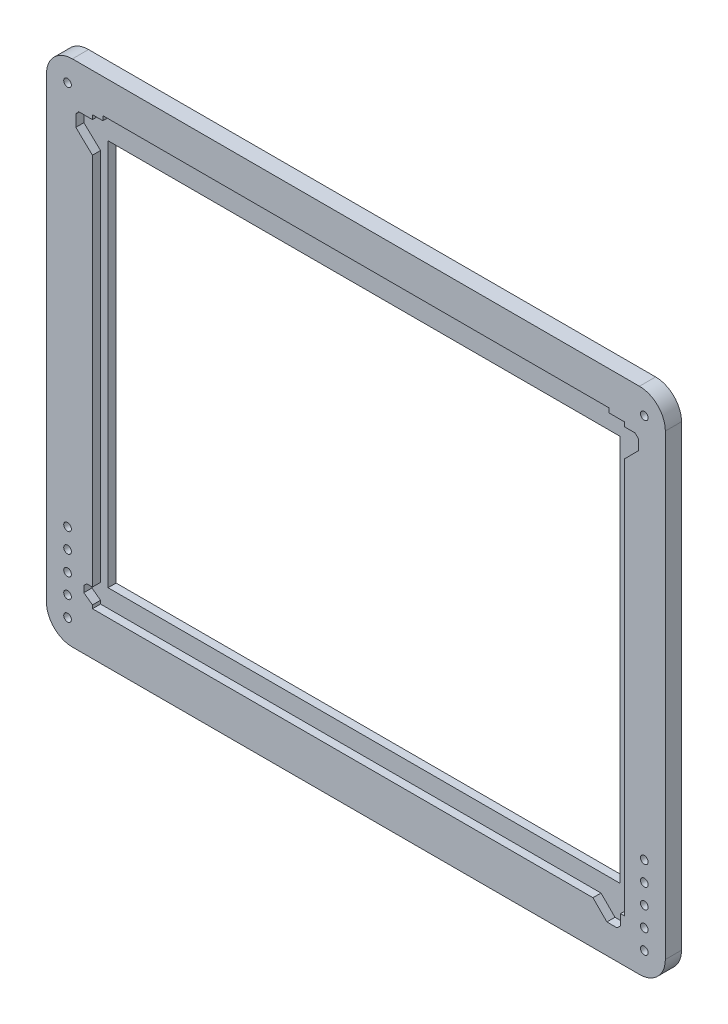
SolidWorks part; units mm, degrees
ref_plane "Front Plane" through (0, 0, 0) normal (0, 0, 1) x (1, 0, 0)
ref_plane "Top Plane" through (0, 0, 0) normal (0, 1, 0) x (1, 0, 0)
ref_plane "Right Plane" through (0, 0, 0) normal (1, 0, 0) x (0, 0, -1)
sketch "Model" plane through (0, 0, 0) normal (0, 0, 1) x (1, 0, 0)
  line L5 (502.8049, 173.3245) -> (506.8028, 173.3245)
  line L6 (285.9719, 190.015) -> (508.635, 190.015)
  line L7 (275.8119, 179.855) -> (275.8119, 0.1472)
  line L8 (285.9719, -10.0128) -> (508.635, -10.0128)
  line L9 (518.795, 179.855) -> (518.795, 0.1472)
  line L10 (275.8119, 190.015) -> (518.795, -10.0128) construction
  line L11 (275.8119, -10.0128) -> (518.795, 190.015) construction
  line L12 (506.8028, 173.3245) -> (508.2449, 172.0012)
  line L13 (508.2449, 172.0012) -> (508.2449, 168.0007)
  line L14 (508.2449, 168.0007) -> (502.8049, 162.5053)
  line L15 (293.8035, 173.3245) -> (288.3999, 173.3245)
  line L16 (502.8049, 173.3245) -> (502.8049, 175.0009)
  line L17 (288.3999, 173.3245) -> (287.2685, 172.0012)
  line L18 (287.2685, 172.0012) -> (287.2685, 168.0007)
  line L19 (287.2685, 168.0007) -> (287.2685, 167.4389)
  line L20 (287.2685, 167.4389) -> (293.8035, 161.2427)
  line L21 (490.3299, 7.0002) -> (495.8046, 1.4905)
  line L22 (495.8046, 1.4905) -> (499.8051, 1.4905)
  line L23 (499.8051, 1.4905) -> (501.1696, 2.8462)
  line L24 (501.1696, 2.8462) -> (501.1696, 7.0002)
  line L25 (293.8035, 14.3759) -> (291.5371, 14.3759)
  line L26 (291.5371, 14.3759) -> (290.417, 13.2246)
  line L27 (290.417, 13.2246) -> (290.417, 10.7666)
  line L28 (290.417, 10.7666) -> (293.8035, 8.3085)
  line L29 (293.8035, 8.3085) -> (293.8035, 7.0002)
  line L30 (293.8035, 161.2427) -> (293.8035, 14.3759)
  line L31 (501.1696, 7.0002) -> (502.8049, 7.0002)
  line L1351 (296.8033, 165.9992) -> (497.8036, 165.9992)
  line L1353 (296.8033, 14.0005) -> (296.8033, 165.9992)
  line L1355 (497.8036, 14.0005) -> (296.8033, 14.0005)
  line L1357 (497.8036, 165.9992) -> (497.8036, 14.0005)
  line L1381 (502.8049, 7.0002) -> (502.8049, 162.5053)
  line L1382 (293.8035, 7.0002) -> (490.3299, 7.0002)
  line L1383 (293.8035, 175.0009) -> (293.8035, 173.3245)
  line L1384 (502.8049, 175.0009) -> (293.8035, 175.0009)
  arc A0 (275.8119, 0.1472) -> (285.9719, -10.0128) centre (285.9719, 0.1472) ccw
  arc A1 (508.635, -10.0128) -> (518.795, 0.1472) centre (508.635, 0.1472) ccw
  arc A2 (508.635, 190.015) -> (518.795, 179.855) centre (508.635, 179.855) cw
  arc A3 (285.9719, 190.015) -> (275.8119, 179.855) centre (285.9719, 179.855) ccw
  point P0 (397.3034, 90.0011)
extrude "Boss-Extrude1" add sketch "Model" along normal blind 6.35 contours L6 A3 L7 A0 L8 A1 L9 A2 L1384 L16 L5 L12 L13 L14 L1381 L31 L24 L23 L22 L21 L1382 L29 L28 L27 L26 L25 L30 L20 L19 L18 L17 L15 L1383 | L16 L1384 L1383 L15 L17 L18 L19 L20 L30 L25 L26 L27 L28 L29 L1382 L21 L22 L23 L24 L31 L1381 L14 L13 L12 L5 L1351 L1357 L1355 L1353 | L1357 L1351 L1353 L1355
sketch "Sketch2" plane through (0, 0, 6.35) normal (0, 0, 1) x (1, 0, 0)
  line L0 (296.8033, 166.0004) -> (497.8036, 166.0004)
  line L1 (296.8033, 14.0017) -> (296.8033, 166.0004)
  line L2 (497.8036, 14.0017) -> (296.8033, 14.0017)
  line L3 (497.8036, 166.0004) -> (497.8036, 14.0017)
sketch "Sketch4" plane through (0, 0, 6.35) normal (0, 0, 1) x (1, 0, 0)
  line L0 (502.8529, 173.29) -> (506.8509, 173.29)
  line L1 (275.8599, 189.9805) -> (518.843, -10.0474) construction
  line L2 (275.8599, -10.0474) -> (518.843, 189.9805) construction
  line L3 (506.8509, 173.29) -> (508.2929, 171.9666)
  line L4 (508.2929, 171.9666) -> (508.2929, 167.9661)
  line L5 (508.2929, 167.9661) -> (502.8529, 162.4708)
  line L6 (293.8515, 173.29) -> (288.448, 173.29)
  line L7 (502.8529, 173.29) -> (502.8529, 174.9664)
  line L8 (288.448, 173.29) -> (287.3165, 171.9666)
  line L9 (287.3165, 171.9666) -> (287.3165, 167.9661)
  line L10 (287.3165, 167.9661) -> (287.3165, 167.4044)
  line L11 (287.3165, 167.4044) -> (293.8515, 161.2081)
  line L12 (490.378, 6.9657) -> (495.8527, 1.4559)
  line L13 (495.8527, 1.4559) -> (499.8532, 1.4559)
  line L14 (499.8532, 1.4559) -> (501.2176, 2.8117)
  line L15 (501.2176, 2.8117) -> (501.2176, 6.9657)
  line L16 (293.8515, 14.3413) -> (291.5851, 14.3413)
  line L17 (291.5851, 14.3413) -> (290.465, 13.1901)
  line L18 (290.465, 13.1901) -> (290.465, 10.732)
  line L19 (290.465, 10.732) -> (293.8515, 8.274)
  line L20 (293.8515, 8.274) -> (293.8515, 6.9657)
  line L21 (293.8515, 161.2081) -> (293.8515, 14.3413)
  line L22 (501.2176, 6.9657) -> (502.8529, 6.9657)
  line L27 (502.8529, 6.9657) -> (502.8529, 162.4708)
  line L28 (293.8515, 6.9657) -> (490.378, 6.9657)
  line L29 (293.8515, 174.9664) -> (293.8515, 173.29)
  line L30 (502.8529, 174.9664) -> (293.8515, 174.9664)
  point P0 (397.3515, 89.9665)
extrude "Cut-Extrude6" cut sketch "Sketch2" against normal through all
extrude "Cut-Extrude7" cut sketch "Sketch4" against normal blind 3.175
sketch "Sketch5" plane through (0, 0, 6.35) normal (0, 0, 1) x (1, 0, 0)
  line L0 (397.3034, 190.015) -> (397.3034, -10.0128) construction
  line L1 (285.9719, 190.015) -> (508.635, 190.015) construction
  line L2 (285.9719, -10.0128) -> (508.635, -10.0128) construction
  line L3 (275.8119, 90.0011) -> (518.795, 90.0011) construction
  line L4 (275.8119, 179.855) -> (275.8119, 0.1472) construction
  line L5 (518.795, 179.855) -> (518.795, 0.1472) construction
  circle A1 centre (284.0709, 180.9201) radius 1.5
  circle A2 centre (510.536, 180.9201) radius 1.5
  circle A3 centre (510.536, -0.9179) radius 1.5
  circle A4 centre (284.0709, -0.9179) radius 1.5
  circle A6 centre (284.0709, 6.7925) radius 1.5
  circle A7 centre (284.0709, 14.5029) radius 1.5
  circle A8 centre (284.0709, 22.2134) radius 1.5
  circle A9 centre (284.0709, 29.9238) radius 1.5
  circle A10 centre (510.536, 29.9238) radius 1.5
  circle A11 centre (510.536, 22.2134) radius 1.5
  circle A12 centre (510.536, 14.5029) radius 1.5
  circle A13 centre (510.536, 6.7925) radius 1.5
extrude "Cut-Extrude8" cut sketch "Sketch5" against normal through all
sketch "Sketch6" plane through (0, 0, 6.35) normal (0, 0, 1) x (1, 0, 0)
  line L0 (397.3034, 190.015) -> (397.3034, 14.0017) construction
  line L1 (285.9719, 190.015) -> (508.635, 190.015) construction
  line L2 (497.8036, 14.0017) -> (296.8033, 14.0017) construction
  line L3 (275.8119, 90.0011) -> (518.795, 90.0011) construction
  line L4 (275.8119, 179.855) -> (275.8119, 0.1472) construction
  line L5 (518.795, 179.855) -> (518.795, 0.1472) construction
  line L6 (502.8529, 174.9664) -> (293.8515, 174.9664) construction
  line L7 (297.9506, 176.6972) -> (496.6562, 176.6972)
  line L8 (297.9506, 176.6972) -> (297.9506, 173.2355)
  line L9 (297.9506, 173.2355) -> (496.6562, 173.2355)
  line L10 (496.6562, 176.6972) -> (496.6562, 173.2355)
  line L11 (297.9506, 176.6972) -> (496.6562, 173.2355) construction
  line L12 (297.9506, 173.2355) -> (496.6562, 176.6972) construction
  point P12 (397.3034, 174.9664)
extrude "Cut-Extrude9" cut sketch "Sketch6" against normal blind 3.175
